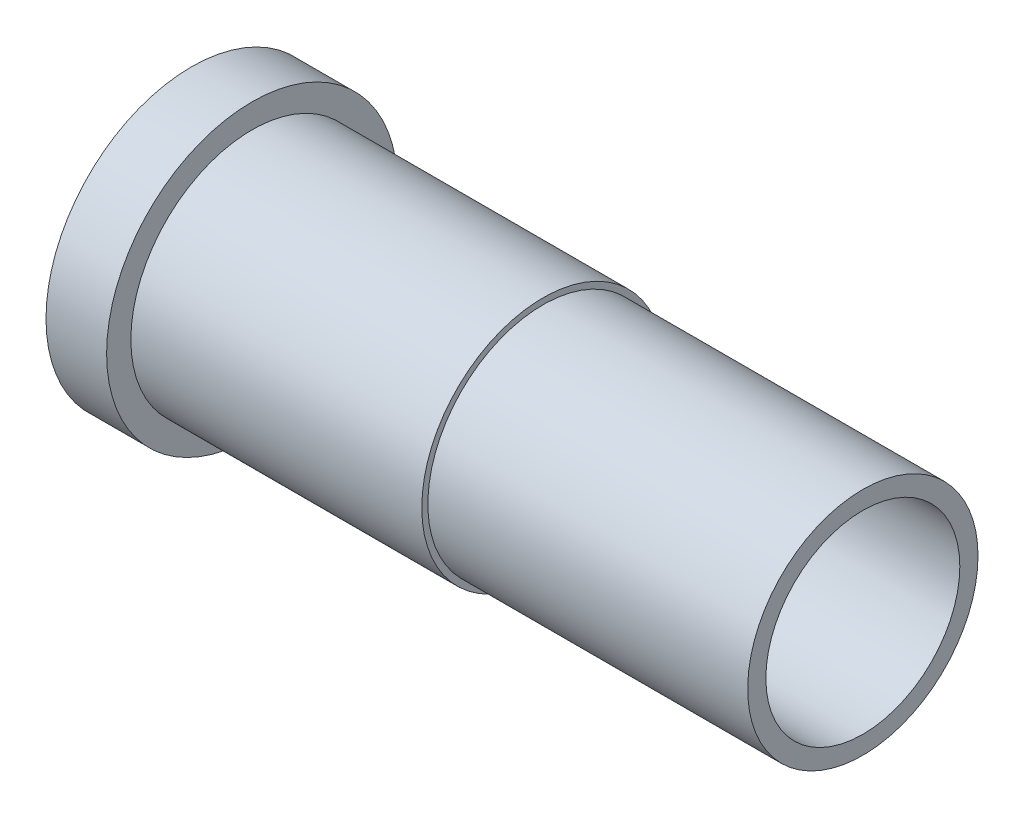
SolidWorks part; units mm, degrees
ref_plane "Plan de face" through (0, 0, 0) normal (0, 0, 1) x (1, 0, 0)
ref_plane "Plan de dessus" through (0, 0, 0) normal (0, 1, 0) x (1, 0, 0)
ref_plane "Plan de droite" through (0, 0, 0) normal (1, 0, 0) x (0, 0, -1)
sketch "Esquisse1" plane through (0, 0, 0) normal (0, 0, 1) x (1, 0, 0)
  line L0 (-21.6393, 0) -> (77.4742, 0) construction
  line L1 (0, 8) -> (0, 12)
  line L2 (0, 12) -> (5, 12)
  line L3 (5, 12) -> (5, 10)
  line L4 (5, 10) -> (59, 10)
  line L5 (59, 10) -> (59, 8)
  line L6 (59, 8) -> (0, 8)
  dimension "D1" = 5
  dimension "D2" = 24
  dimension "D3" = 16
  dimension "D4" = 20
  dimension "D5" = 59
revolve "Révolution1" add sketch "Esquisse1" angle 360 about L0
chamfer "Chanfrein1" distance 0.5 angle 45 1 edges at (0, 0, 8)
sketch "Esquisse2" plane through (59, 0, 0) normal (1, 0, 0) x (0, 0, -1)
  circle A0 centre (0, 0) radius 9.5
  dimension "D1" = 19
extrude "Enlèv. mat.-Extru.1" cut sketch "Esquisse2" against normal blind 30 flip side to cut
sketch "Esquisse3" plane through (59, 0, 0) normal (1, 0, 0) x (0, 0, -1)
  circle A0 centre (0, 0) radius 9.5
  circle A1 centre (0, 0) radius 9.5 construction
extrude "Enlèv. mat.-Extru.2" cut sketch "Esquisse3" against normal up to surface (3.617 mm away)
